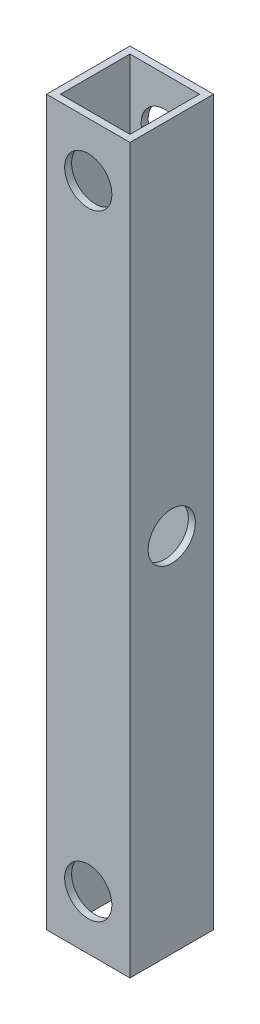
SolidWorks part; units mm, degrees
ref_plane "Front Plane" through (0, 0, 0) normal (0, 0, 1) x (1, 0, 0)
ref_plane "Top Plane" through (0, 0, 0) normal (0, 1, 0) x (1, 0, 0)
ref_plane "Right Plane" through (0, 0, 0) normal (1, 0, 0) x (0, 0, -1)
sketch "Sketch1" plane through (0, 0, 0) normal (0, 1, 0) x (1, 0, 0)
  line L1 (-15.875, -15.875) -> (15.875, -15.875)
  line L2 (-15.875, -15.875) -> (-15.875, 15.875)
  line L3 (-15.875, 15.875) -> (15.875, 15.875)
  line L4 (15.875, -15.875) -> (15.875, 15.875)
  line L5 (-15.875, -15.875) -> (15.875, 15.875) construction
  line L6 (-15.875, 15.875) -> (15.875, -15.875) construction
  line L7 (-19.05, -19.05) -> (19.05, -19.05)
  line L8 (-19.05, -19.05) -> (-19.05, 19.05)
  line L9 (-19.05, 19.05) -> (19.05, 19.05)
  line L10 (19.05, -19.05) -> (19.05, 19.05)
  line L11 (-19.05, -19.05) -> (19.05, 19.05) construction
  line L12 (-19.05, 19.05) -> (19.05, -19.05) construction
  point P0 (0, 0)
  point P6 (0, 0)
  dimension "D1" = 38.1
  dimension "D2" = 3.175
extrude "Boss-Extrude1" add sketch "Sketch1" along normal mid plane 330.2
sketch "Sketch2" plane through (0, 0, 19.05) normal (0, 0, 1) x (1, 0, 0)
  line L0 (0, 140.4251) -> (0, -140.4251) construction
  circle A0 centre (0, 140.4251) radius 10.7696
  circle A1 centre (0, -140.4251) radius 10.7696
  point P3 (0, 0)
  dimension "D2" = 21.5392
  dimension "D1" = 280.8503
extrude "Cut-Extrude1" cut sketch "Sketch2" against normal through all
sketch "Sketch3" plane through (19.05, 0, 0) normal (1, 0, 0) x (0, 0, -1)
  circle A0 centre (0, 0) radius 10.7696
  dimension "D1" = 21.5392
extrude "Cut-Extrude2" cut sketch "Sketch3" against normal through all
